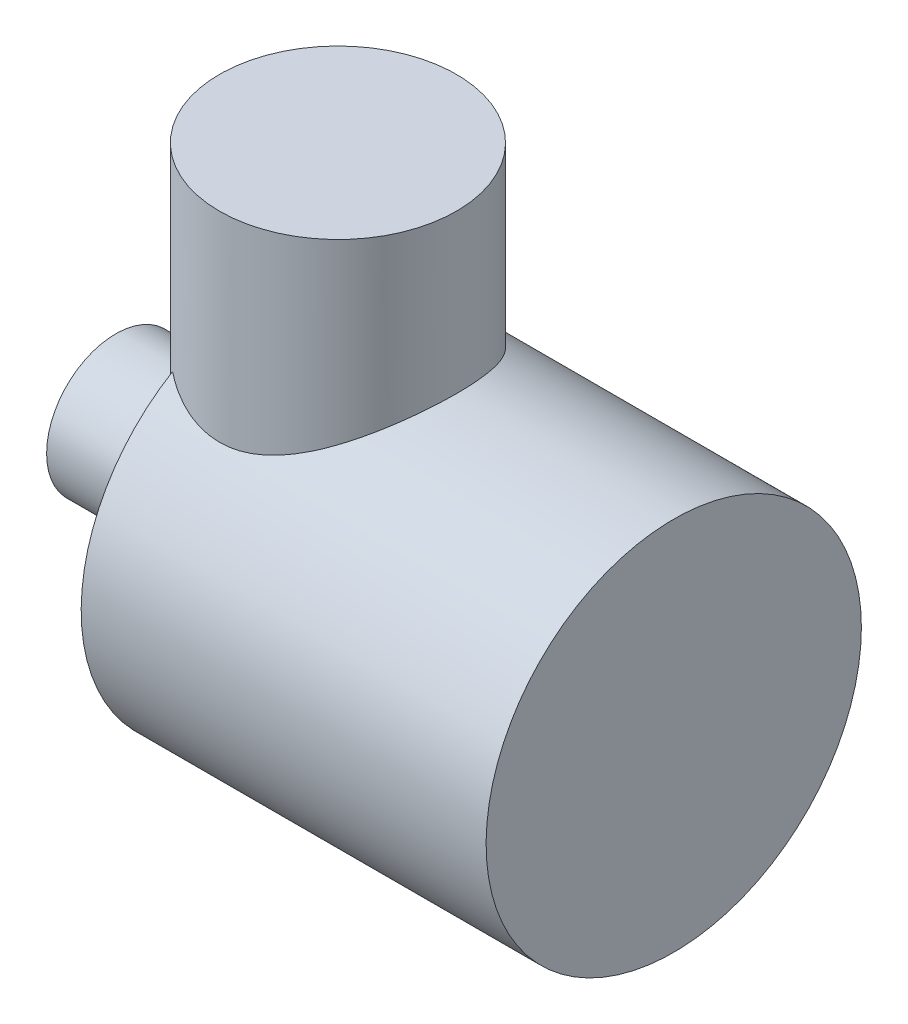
SolidWorks part; units mm, degrees
ref_plane "前视基准面" through (0, 0, 0) normal (0, 0, 1) x (1, 0, 0)
ref_plane "上视基准面" through (0, 0, 0) normal (0, 1, 0) x (1, 0, 0)
ref_plane "右视基准面" through (0, 0, 0) normal (1, 0, 0) x (0, 0, -1)
sketch "草图1" plane through (0, 0, 0) normal (1, 0, 0) x (0, 0, -1)
  circle A0 centre (0, 0) radius 76
extrude "拉伸1" add sketch "草图1" along normal blind 164
sketch "草图2" plane through (0, 0, 0) normal (-1, 0, 0) x (0, 0, 1)
  circle A0 centre (0, 0) radius 28
extrude "拉伸2" add sketch "草图2" along normal blind 62
sketch "草图3" plane through (0, 0, 0) normal (0, 1, 0) x (1, 0, 0)
  circle A0 centre (28, 0) radius 48
  dimension "D1" = 28
extrude "拉伸3" add sketch "草图3" along normal blind 140 and the other way blind 20
